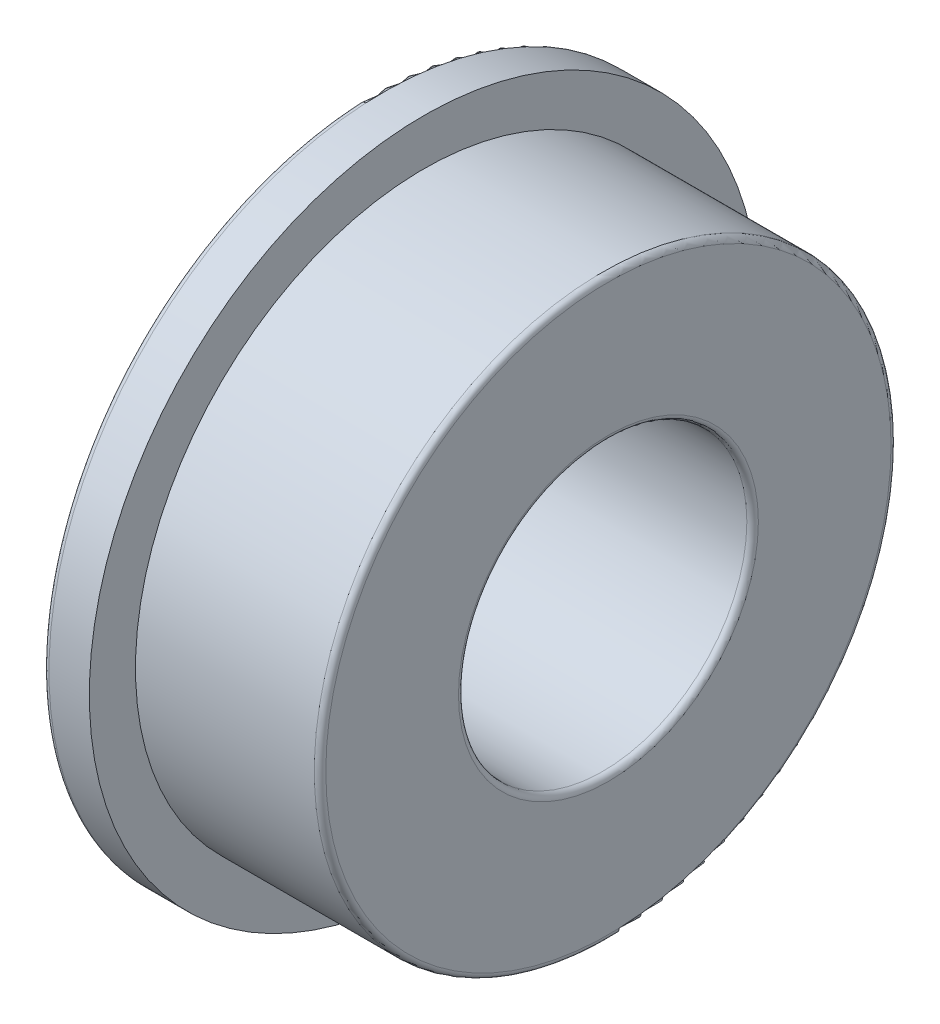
SolidWorks part; units mm, degrees
ref_plane "前视基准面" through (0, 0, 0) normal (0, 0, 1) x (1, 0, 0)
ref_plane "上视基准面" through (0, 0, 0) normal (0, 1, 0) x (1, 0, 0)
ref_plane "右视基准面" through (0, 0, 0) normal (1, 0, 0) x (0, 0, -1)
sketch "草图1" plane through (0, 0, 0) normal (1, 0, 0) x (0, 0, -1)
  circle A0 centre (0, 0) radius 5.8
  circle A1 centre (0, 0) radius 2.5
  dimension "D1" = 11.6
  dimension "D2" = 5
extrude "凸台-拉伸1" add sketch "草图1" along normal blind 0.8
sketch "草图2" plane through (0.8, 0, 0) normal (1, 0, 0) x (0, 0, -1)
  circle A0 centre (0, 0) radius 2.5
  circle A1 centre (0, 0) radius 5
  dimension "D1" = 10
extrude "凸台-拉伸2" add sketch "草图2" along normal blind 3.2
fillet "圆角1" radius 0.1 4 edges at (0, 0, -2.5) (0, 0, -5.8) (4, 0, -2.5) (4, 0, -5)
